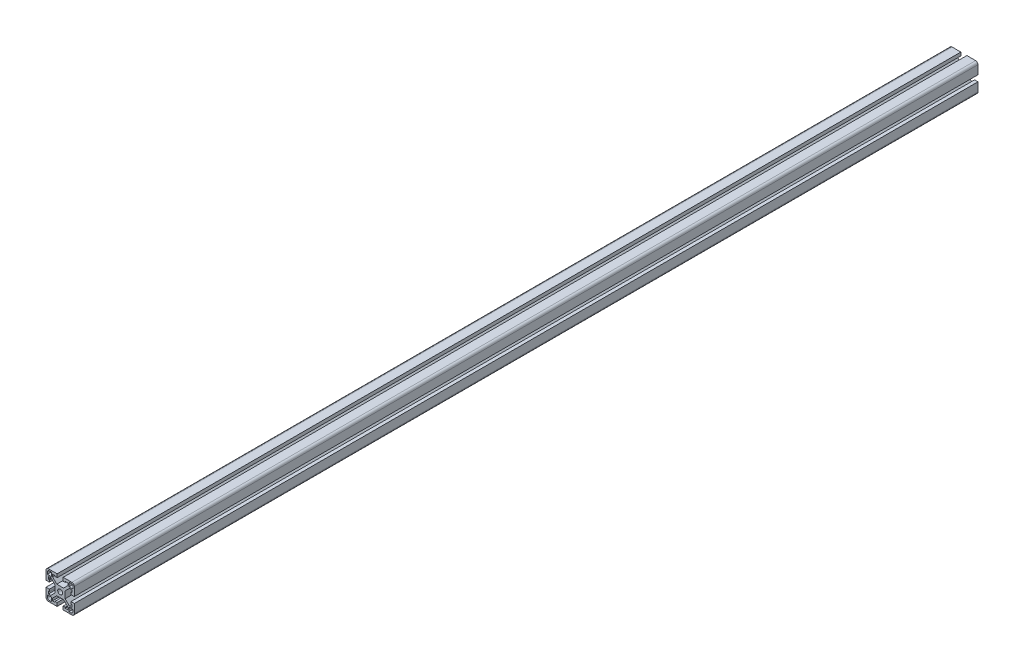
SolidWorks part; units mm, degrees
ref_plane "Front" through (0, 0, 0) normal (0, 0, 1) x (1, 0, 0)
ref_plane "Top" through (0, 0, 0) normal (0, 1, 0) x (1, 0, 0)
ref_plane "Right" through (0, 0, 0) normal (1, 0, 0) x (0, 0, -1)
sketch "Sketch1" plane through (0, 0, 0) normal (0, 0, 1) x (1, 0, 0)
  line L0 (-11.8872, 17.272) -> (-14.478, 17.272)
  line L1 (-11.8872, 11.8872) -> (-11.8872, 17.272)
  line L2 (-17.272, 11.8872) -> (-11.8872, 11.8872)
  line L3 (-17.272, 14.478) -> (-17.272, 11.8872)
  line L4 (14.478, 17.272) -> (11.8872, 17.272)
  line L5 (17.272, 11.8872) -> (17.272, 14.478)
  line L6 (11.8872, 11.8872) -> (17.272, 11.8872)
  line L7 (11.8872, 17.272) -> (11.8872, 11.8872)
  line L8 (11.8872, -17.272) -> (14.478, -17.272)
  line L9 (11.8872, -11.8872) -> (11.8872, -17.272)
  line L10 (17.272, -11.8872) -> (11.8872, -11.8872)
  line L11 (17.272, -14.478) -> (17.272, -11.8872)
  line L12 (-14.478, -17.272) -> (-11.8872, -17.272)
  line L13 (-17.272, -11.8872) -> (-17.272, -14.478)
  line L14 (-11.8872, -11.8872) -> (-17.272, -11.8872)
  line L15 (-11.8872, -17.272) -> (-11.8872, -11.8872)
  line L16 (-6.731, 4.5757) -> (-6.731, -4.5757)
  line L17 (-6.731, -4.5757) -> (-12.4423, -10.287)
  line L18 (-12.4423, -10.287) -> (-15.6718, -10.287)
  line L19 (-15.6718, -10.287) -> (-15.6718, -6.858)
  line L20 (-15.6718, -6.858) -> (-14.478, -6.858)
  line L21 (-14.478, -6.858) -> (-14.478, -4.064)
  line L22 (-14.478, -4.064) -> (-19.05, -4.064)
  line L23 (-19.05, -4.064) -> (-19.05, -15.875)
  line L24 (-15.875, -19.05) -> (-4.064, -19.05)
  line L25 (-4.064, -19.05) -> (-4.064, -14.478)
  line L26 (-4.064, -14.478) -> (-6.858, -14.478)
  line L27 (-6.858, -14.478) -> (-6.858, -15.6718)
  line L28 (-6.858, -15.6718) -> (-10.287, -15.6718)
  line L29 (-10.287, -15.6718) -> (-10.287, -12.4423)
  line L30 (-10.287, -12.4423) -> (-4.5757, -6.731)
  line L31 (-4.5757, -6.731) -> (4.5757, -6.731)
  line L32 (4.5757, -6.731) -> (10.287, -12.4423)
  line L33 (10.287, -12.4423) -> (10.287, -15.6718)
  line L34 (10.287, -15.6718) -> (6.858, -15.6718)
  line L35 (6.858, -15.6718) -> (6.858, -14.478)
  line L36 (6.858, -14.478) -> (4.064, -14.478)
  line L37 (4.064, -14.478) -> (4.064, -19.05)
  line L38 (4.064, -19.05) -> (15.875, -19.05)
  line L39 (19.05, -15.875) -> (19.05, -4.064)
  line L40 (19.05, -4.064) -> (14.478, -4.064)
  line L41 (14.478, -4.064) -> (14.478, -6.858)
  line L42 (14.478, -6.858) -> (15.6718, -6.858)
  line L43 (15.6718, -6.858) -> (15.6718, -10.287)
  line L44 (15.6718, -10.287) -> (12.4423, -10.287)
  line L45 (12.4423, -10.287) -> (6.731, -4.5757)
  line L46 (6.731, -4.5757) -> (6.731, 4.5757)
  line L47 (6.731, 4.5757) -> (12.4423, 10.287)
  line L48 (12.4423, 10.287) -> (15.6718, 10.287)
  line L49 (15.6718, 10.287) -> (15.6718, 6.858)
  line L50 (15.6718, 6.858) -> (14.478, 6.858)
  line L51 (14.478, 6.858) -> (14.478, 4.064)
  line L52 (14.478, 4.064) -> (19.05, 4.064)
  line L53 (19.05, 4.064) -> (19.05, 15.875)
  line L54 (15.875, 19.05) -> (4.064, 19.05)
  line L55 (4.064, 19.05) -> (4.064, 14.478)
  line L56 (4.064, 14.478) -> (6.858, 14.478)
  line L57 (6.858, 14.478) -> (6.858, 15.6718)
  line L58 (6.858, 15.6718) -> (10.287, 15.6718)
  line L59 (10.287, 15.6718) -> (10.287, 12.4423)
  line L60 (10.287, 12.4423) -> (4.5757, 6.731)
  line L61 (4.5757, 6.731) -> (-4.5757, 6.731)
  line L62 (-4.5757, 6.731) -> (-10.287, 12.4423)
  line L63 (-10.287, 12.4423) -> (-10.287, 15.6718)
  line L64 (-10.287, 15.6718) -> (-6.858, 15.6718)
  line L65 (-6.858, 15.6718) -> (-6.858, 14.478)
  line L66 (-6.858, 14.478) -> (-4.064, 14.478)
  line L67 (-4.064, 14.478) -> (-4.064, 19.05)
  line L68 (-4.064, 19.05) -> (-15.875, 19.05)
  line L69 (-19.05, 15.875) -> (-19.05, 4.064)
  line L70 (-19.05, 4.064) -> (-14.478, 4.064)
  line L71 (-14.478, 4.064) -> (-14.478, 6.858)
  line L72 (-14.478, 6.858) -> (-15.6718, 6.858)
  line L73 (-15.6718, 6.858) -> (-15.6718, 10.287)
  line L74 (-15.6718, 10.287) -> (-12.4423, 10.287)
  line L75 (-12.4423, 10.287) -> (-6.731, 4.5757)
  circle A0 centre (0, 0) radius 3.2639
  arc A1 (-19.05, -15.875) -> (-15.875, -19.05) centre (-15.875, -15.875) ccw
  arc A2 (15.875, -19.05) -> (19.05, -15.875) centre (15.875, -15.875) ccw
  arc A3 (19.05, 15.875) -> (15.875, 19.05) centre (15.875, 15.875) ccw
  arc A4 (-15.875, 19.05) -> (-19.05, 15.875) centre (-15.875, 15.875) ccw
  arc A5 (-14.478, 17.272) -> (-17.272, 14.478) centre (-14.478, 14.478) ccw
  arc A6 (17.272, 14.478) -> (14.478, 17.272) centre (14.478, 14.478) ccw
  arc A7 (14.478, -17.272) -> (17.272, -14.478) centre (14.478, -14.478) ccw
  arc A8 (-17.272, -14.478) -> (-14.478, -17.272) centre (-14.478, -14.478) ccw
extrude "Boss-Extrude1" add sketch "Sketch1" against normal up to surface (1217.803 mm away)
